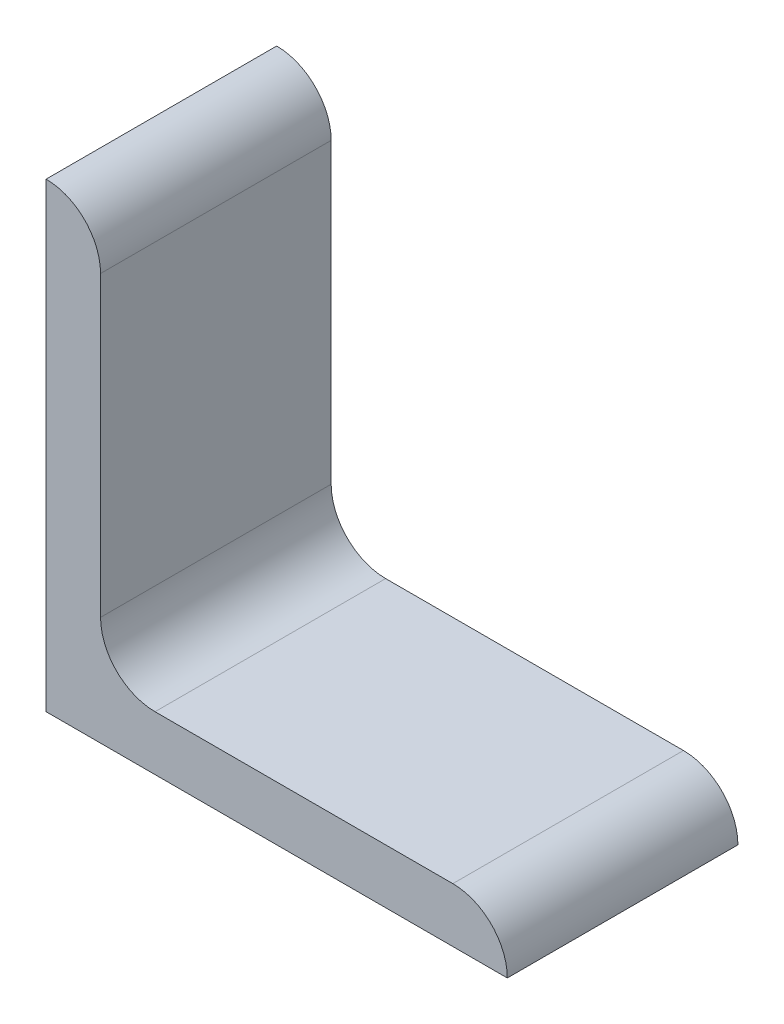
SolidWorks part; units mm, degrees
ref_plane "Plane1" through (0, 0, 0) normal (0, 0, 1) x (1, 0, 0)
ref_plane "Plane2" through (0, 0, 0) normal (0, 1, 0) x (1, 0, 0)
ref_plane "Plane3" through (0, 0, 0) normal (1, 0, 0) x (0, 0, -1)
other "Configuration Table"
sketch "Sketch1" plane through (0, 0, 0) normal (0, 0, 1) x (1, 0, 0)
  line L0 (0, 50.8) -> (0, 0)
  line L1 (0, 50.8) -> (9.525, 50.8) construction
  line L2 (6, 50.8) -> (6, 12)
  line L3 (12, 6) -> (50.8, 6)
  line L4 (50.8, 9.525) -> (50.8, 0) construction
  line L5 (50.8, 0) -> (0, 0)
  line L6 (50.8, 6) -> (50.8, 0)
  line L7 (0, 50.8) -> (6, 50.8)
  arc A2 (12, 6) -> (6, 12) centre (12, 12) cw
  dimension "Radius_1" = 6
  dimension "V_leg" = 50.8
  dimension "H_leg" = 50.8
extrude "BaseSteelAngle" add sketch "Sketch1" along normal mid plane 25.4
fillet "ToeFillet" radius 6 6 edges at (6, 50.8, 0) (50.8, 6, 0) (3, 50.8, 12.7) (50.8, 3, 12.7) (3, 50.8, -12.7) (50.8, 3, -12.7)
